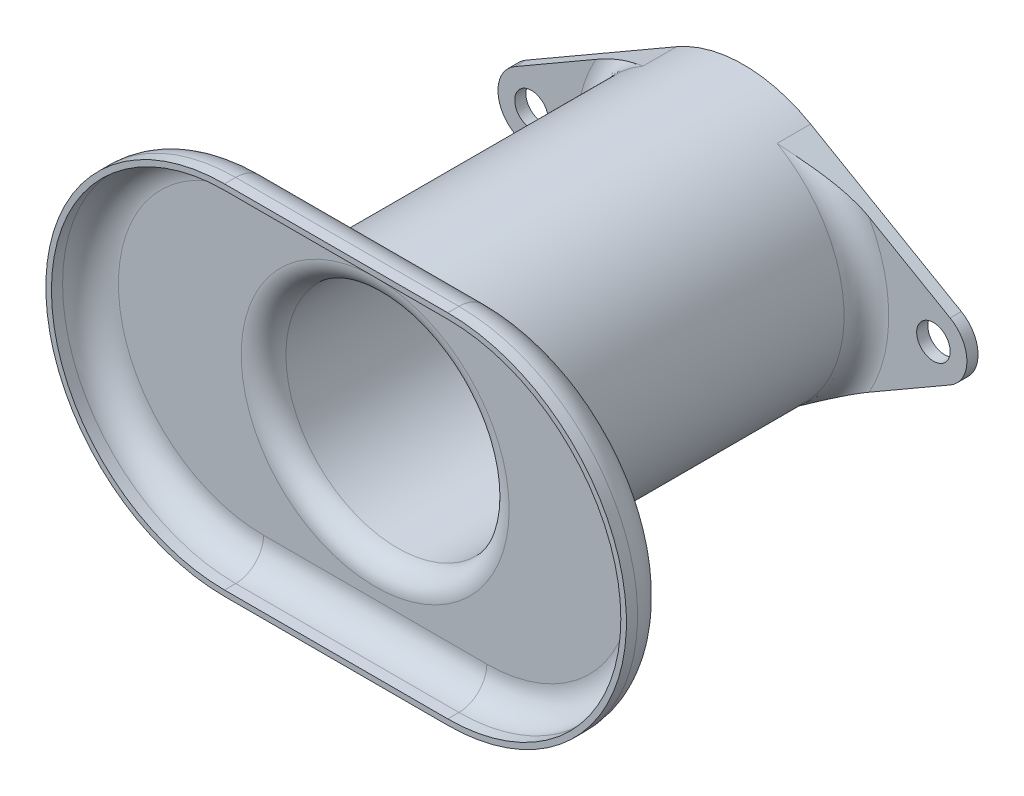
SolidWorks part; units mm, degrees
ref_plane "Front Plane" through (0, 0, 0) normal (0, 0, 1) x (1, 0, 0)
ref_plane "Top Plane" through (0, 0, 0) normal (0, 1, 0) x (1, 0, 0)
ref_plane "Right Plane" through (0, 0, 0) normal (1, 0, 0) x (0, 0, -1)
ref_plane "Plane1" through (0, 0, 99.0595) normal (0, 0, -1) x (-1, 0, 0)
sketch "Sketch1" plane through (0, 0, 99.0595) normal (0, 0, -1) x (-1, 0, 0)
  line L0 (67.9546, 84.6932) -> (4.4546, 84.6932)
  line L1 (4.4546, -16.9068) -> (67.9546, -16.9068)
  arc A0 (67.9546, -16.9068) -> (67.9546, 84.6932) centre (67.9546, 33.8932) ccw
  arc A1 (4.4546, 84.6932) -> (4.4546, -16.9068) centre (4.4546, 33.8932) ccw
extrude "Boss-Extrude1" add sketch "Sketch1" against normal blind 12.7
sketch "Sketch2" plane through (0, 0, 99.0595) normal (0, 0, -1) x (-1, 0, 0)
  circle A0 centre (36.2046, 33.8932) radius 38.1
extrude "Boss-Extrude2" add sketch "Sketch2" along normal blind 100
sketch "Sketch3" plane through (0, 0, -0.9405) normal (0, 0, -1) x (-1, 0, 0)
  line L0 (17.1546, 0.8976) -> (-25.7079, 25.6443)
  line L1 (-25.7079, 42.1421) -> (17.1546, 66.8888)
  line L2 (55.2546, 66.8888) -> (98.1171, 42.1421)
  line L3 (98.1171, 25.6443) -> (55.2546, 0.8976)
  arc A0 (55.2546, 0.8976) -> (17.1546, 0.8976) centre (36.2046, 33.8932) cw
  arc A1 (-25.7079, 25.6443) -> (-25.7079, 42.1421) centre (-20.9454, 33.8932) cw
  arc A2 (17.1546, 66.8888) -> (55.2546, 66.8888) centre (36.2046, 33.8932) cw
  arc A3 (98.1171, 42.1421) -> (98.1171, 25.6443) centre (93.3546, 33.8932) cw
extrude "Boss-Extrude3" add sketch "Sketch3" along normal blind 3.175
sketch "Sketch4" plane through (0, 0, 111.7595) normal (0, 0, 1) x (1, 0, 0)
  line L0 (-67.9546, -15.3193) -> (-4.4546, -15.3193)
  line L1 (-4.4546, 83.1057) -> (-67.9546, 83.1057)
  arc A0 (-4.4546, -15.3193) -> (-4.4546, 83.1057) centre (-4.4546, 33.8932) ccw
  arc A1 (-67.9546, 83.1057) -> (-67.9546, -15.3193) centre (-67.9546, 33.8932) ccw
extrude "Cut-Extrude1" cut sketch "Sketch4" against normal blind 11.1125
hole_wizard "Hole1" positions "Sketch6" profile "Sketch5" legacy
sketch "Sketch6" plane through (0, 0, 100.647) normal (0, 0, 1) x (1, 0, 0)
  point P0 (-36.2046, 33.8932)
sketch "Sketch5" plane through (-36.2046, 33.8932, 100.647) normal (1, 0, 0) x (0, -1, 0)
  line L0 (0, 0) -> (0, 104.7625)
  line L1 (0, 104.7625) -> (31.75, 104.7625)
  line L2 (31.75, 104.7625) -> (31.75, 0)
  line L3 (31.75, 0) -> (0, 0)
  line L4 (0, 110) -> (0, -10) construction
  dimension "Diameter" = 63.5
  dimension "Depth" = 104.7625
hole_wizard "Hole2" positions "Sketch8" profile "Sketch7" legacy
sketch "Sketch8" plane through (0, 0, -0.9405) normal (0, 0, 1) x (1, 0, 0)
  point P0 (-93.3546, 33.8932)
sketch "Sketch7" plane through (-93.3546, 33.8932, -0.9405) normal (1, 0, 0) x (0, -1, 0)
  line L0 (0, 0) -> (0, 3.175)
  line L1 (0, 3.175) -> (4.7625, 3.175)
  line L2 (4.7625, 3.175) -> (4.7625, 0)
  line L3 (4.7625, 0) -> (0, 0)
  line L4 (0, 110) -> (0, -10) construction
  dimension "Diameter" = 9.525
  dimension "Depth" = 3.175
hole_wizard "Hole3" positions "Sketch10" profile "Sketch9" legacy
sketch "Sketch10" plane through (0, 0, -0.9405) normal (0, 0, 1) x (1, 0, 0)
  point P0 (20.9454, 33.8932)
sketch "Sketch9" plane through (20.9454, 33.8932, -0.9405) normal (1, 0, 0) x (0, -1, 0)
  line L0 (0, 0) -> (0, 3.175)
  line L1 (0, 3.175) -> (4.7625, 3.175)
  line L2 (4.7625, 3.175) -> (4.7625, 0)
  line L3 (4.7625, 0) -> (0, 0)
  line L4 (0, 110) -> (0, -10) construction
  dimension "Diameter" = 9.525
  dimension "Depth" = 3.175
fillet "Fillet1" radius 9.525 4 edges at (-36.2046, -16.9068, 99.0595) (46.3454, 33.8932, 99.0595) (-118.7546, 33.8932, 99.0595) (-36.2046, 84.6932, 99.0595)
fillet "Fillet2" radius 6.35 1 edges at (-4.4546, 33.8932, 100.647)
fillet "Fillet3" radius 6.35 1 edges
fillet "Fillet4" radius 6.35 1 edges at (-74.3046, 33.8932, 99.0595)
fillet "Fillet5" radius 6.35 1 edges
fillet "Fillet6" radius 7.9375 4 edges at (-36.2046, -15.3193, 100.647) (-117.1671, 33.8932, 100.647) (44.7579, 33.8932, 100.647) (-36.2046, 83.1057, 100.647)
